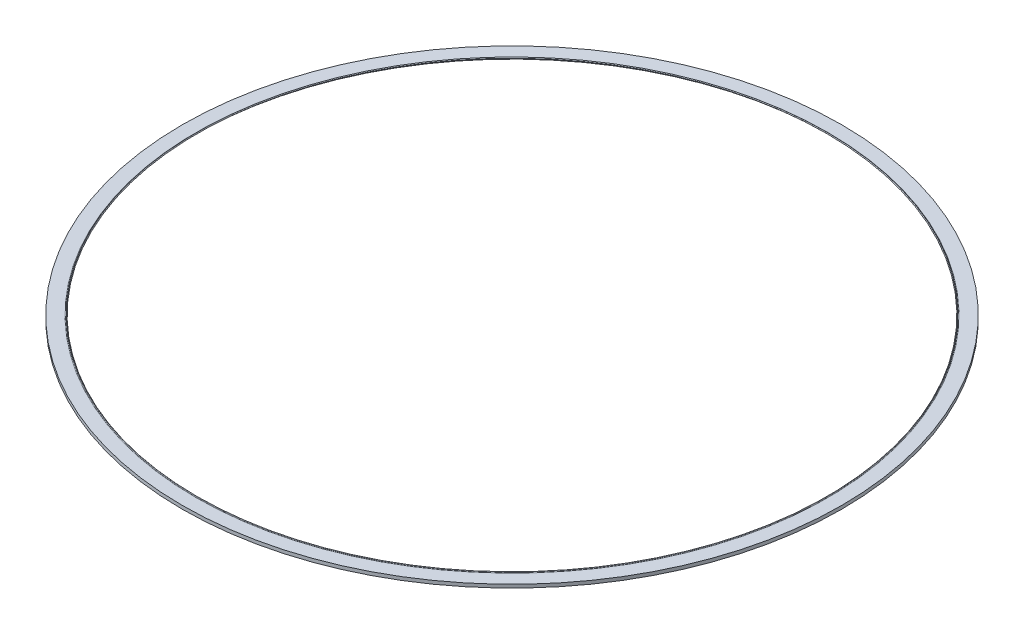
SolidWorks part; units mm, degrees
ref_plane "Front" through (0, 0, 0) normal (0, 0, 1) x (1, 0, 0)
ref_plane "Top" through (0, 0, 0) normal (0, 1, 0) x (1, 0, 0)
ref_plane "Right" through (0, 0, 0) normal (1, 0, 0) x (0, 0, -1)
sketch "Sketch1" plane through (0, 0, 0) normal (0, 0, 1) x (1, 0, 0)
  line L0 (0, 0) -> (-34.2726, 0) construction
  line L1 (0, 0) -> (0, 15.225) construction
  line L2 (-60.0837, -3.8513) -> (-60.0837, 0.3492) construction
  line L3 (-62.6745, 0) -> (-60.4901, 0)
  line L4 (-62.6745, 0) -> (-62.6745, 0.635)
  line L5 (-62.6745, 0.635) -> (-60.095, 0.635)
  line L7 (-7.6671, 0.762) -> (-59.6709, 0.762) construction
  line L8 (-59.8003, 0.6326) -> (-59.8865, 0.5465)
  line L9 (-60.102, 0.4572) -> (-60.4901, 0.4572)
  line L10 (-60.4901, 0.4572) -> (-60.4901, 0)
  line L11 (-60.0052, 0.6722) -> (-59.9225, 0.7549)
  line L12 (-59.8003, 0.6326) -> (-59.9225, 0.7549)
  arc A0 (-60.095, 0.635) -> (-60.0052, 0.6722) centre (-60.095, 0.762) ccw
  arc A1 (-59.8865, 0.5465) -> (-60.102, 0.4572) centre (-60.102, 0.762) cw
  dimension "D10" = 0.127
  dimension "D11" = 0.3048
  dimension "D1" = 0.635
  dimension "D2" = 125.349
  dimension "D3" = 0.7549
  dimension "D4" = 2.5908
  dimension "D5" = 0.762
  dimension "D6" = 0.4127
  dimension "D7" = 45
  dimension "D8" = 2.1844
  dimension "D9" = 0.1778
  dimension "D12" = 2.8742
revolve "Base-Revolve Seal" add sketch "Sketch1" angle 360 about L1
